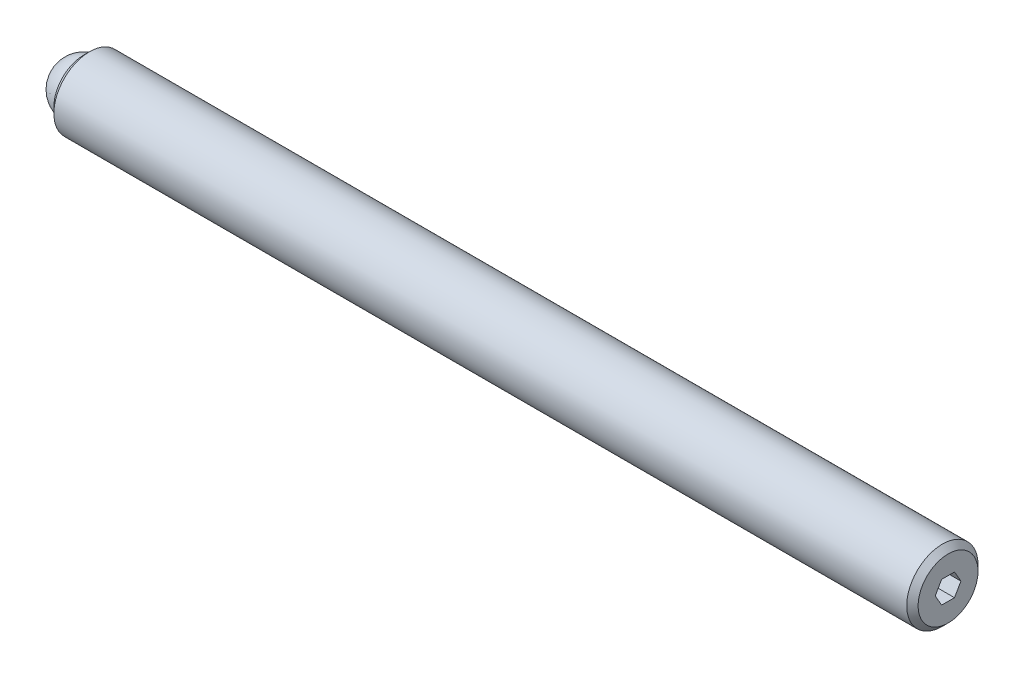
SolidWorks part; units mm, degrees
ref_plane "Front Plane" through (0, 0, 0) normal (0, 0, 1) x (1, 0, 0)
ref_plane "Top Plane" through (0, 0, 0) normal (0, 1, 0) x (1, 0, 0)
ref_plane "Right Plane" through (0, 0, 0) normal (1, 0, 0) x (0, 0, -1)
sketch "Sketch2" plane through (0, 0, 0) normal (1, 0, 0) x (0, 0, -1)
  circle A0 centre (0, 0) radius 3.175
  dimension "D1" = 6.35
extrude "Boss-Extrude1" add sketch "Sketch2" along normal blind 76.9938
sketch "Sketch3" plane through (0, 0, 0) normal (-1, 0, 0) x (0, 0, 1)
  circle A0 centre (0, 0) radius 2.3813
  dimension "D1" = 4.7625
chamfer "Chamfer1" distance 0.508 angle 45 1 edges at (0, 0, -3.175)
chamfer "Chamfer2" distance 0.508 angle 45 1 edges at (76.9938, 0, -3.175)
sketch "Sketch4" plane through (76.9938, 0, 0) normal (1, 0, 0) x (0, 0, -1)
  line L1 (1.1457, 0) -> (0.5728, 0.9922)
  line L2 (0.5728, 0.9922) -> (-0.5728, 0.9922)
  line L3 (-0.5728, 0.9922) -> (-1.1457, 0)
  line L4 (-1.1457, 0) -> (-0.5728, -0.9922)
  line L5 (-0.5728, -0.9922) -> (0.5728, -0.9922)
  line L6 (0.5728, -0.9922) -> (1.1457, 0)
  circle A0 centre (0, 0) radius 0.9922 construction
  dimension "D1" = 1.9844
extrude "Cut-Extrude2" cut sketch "Sketch4" against normal blind 2.286
extrude "Cut-Extrude3" cut sketch "Sketch3" against normal blind 1.9844
sketch "Sketch5" plane through (0, 0, 0) normal (-1, 0, 0) x (0, 0, 1)
  line L0 (0, 0) -> (0, -2.3813)
  line L1 (0, 0) -> (0, 2.3813)
  arc A0 (0, 2.3813) -> (0, -2.3813) centre (0, 0) ccw
  dimension "D1" = 2.3813
revolve "Revolve1" add sketch "Sketch5" angle 360 about L1
